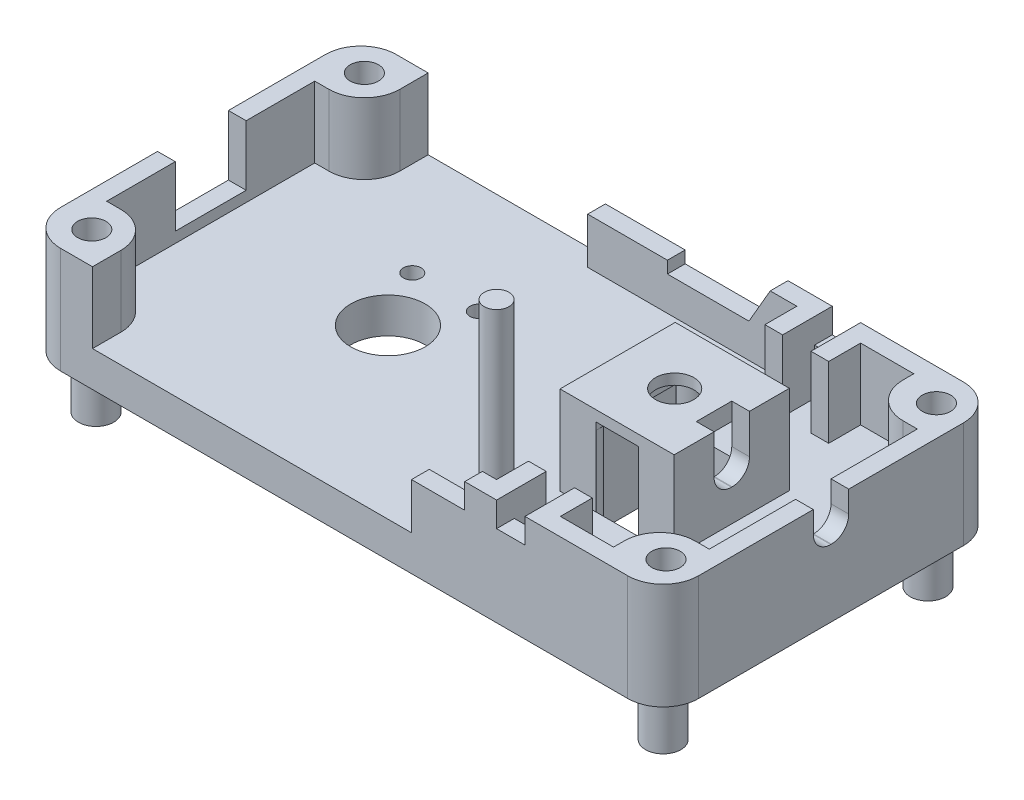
SolidWorks part; units mm, degrees
ref_plane "Front Plane" through (0, 0, 0) normal (0, 0, 1) x (1, 0, 0)
ref_plane "Top Plane" through (0, 0, 0) normal (0, 1, 0) x (1, 0, 0)
ref_plane "Right Plane" through (0, 0, 0) normal (1, 0, 0) x (0, 0, -1)
sketch "Sketch1" plane through (0, 0, 0) normal (0, 1, 0) x (1, 0, 0)
  line L1 (0, 0) -> (-45.72, 0)
  line L2 (0, 0) -> (0, 24.0538)
  line L3 (0, 24.0538) -> (-45.72, 24.0538)
  line L4 (-45.72, 0) -> (-45.72, 24.0538)
  dimension "D1" = 45.72
  dimension "D2" = 24.0538
extrude "Boss-Extrude1" add sketch "Sketch1" along normal blind 7.62
fillet "Fillet1" radius 2.54 4 edges at (0, 3.81, 0) (0, 3.81, -24.0538) (-45.72, 3.81, -24.0538) (-45.72, 3.81, 0)
sketch "Sketch2" plane through (0, 7.62, 0) normal (0, 1, 0) x (1, 0, 0)
  line L0 (-2.54, 24.0538) -> (-43.18, 24.0538) construction
  line L1 (-1.27, 4.572) -> (-44.45, 4.572)
  line L2 (-1.27, 4.572) -> (-1.27, 19.4818)
  line L3 (-1.27, 19.4818) -> (-44.45, 19.4818)
  line L4 (-44.45, 4.572) -> (-44.45, 19.4818)
  line L5 (-1.27, 4.572) -> (-44.45, 19.4818) construction
  line L6 (-1.27, 19.4818) -> (-44.45, 4.572) construction
  line L7 (-45.72, 21.5138) -> (-45.72, 2.54) construction
  line L8 (-43.18, 0) -> (-2.54, 0) construction
  line L9 (0, 2.54) -> (0, 21.5138) construction
  line L10 (0, 12.0269) -> (-45.72, 12.0269) construction
  line L12 (-7.112, 7.8994) -> (-15.2908, 7.8994)
  line L13 (-7.112, 7.8994) -> (-7.112, 16.1544)
  line L14 (-7.112, 16.1544) -> (-15.2908, 16.1544)
  line L15 (-15.2908, 7.8994) -> (-15.2908, 16.1544)
  line L16 (-7.112, 7.8994) -> (-15.2908, 16.1544) construction
  line L17 (-7.112, 16.1544) -> (-15.2908, 7.8994) construction
  point P0 (-22.86, 12.0269)
  point P15 (-11.2014, 12.0269)
  dimension "D1" = 4.572
  dimension "D2" = 1.27
  dimension "D3" = 4.572
  dimension "D4" = 1.27
  dimension "D5" = 7.112
  dimension "D6" = 8.1788
  dimension "D7" = 8.255
extrude "Cut-Extrude1" cut sketch "Sketch2" against normal blind 5.08
sketch "Sketch3" plane through (0, 7.62, 0) normal (0, 1, 0) x (1, 0, 0)
  line L0 (-44.45, 4.572) -> (-1.27, 4.572) construction
  line L1 (-18.034, 4.572) -> (-40.894, 4.572)
  line L2 (-18.034, 4.572) -> (-18.034, 0)
  line L3 (-18.034, 0) -> (-40.894, 0)
  line L4 (-40.894, 4.572) -> (-40.894, 0)
  line L5 (-43.18, 0) -> (-2.54, 0) construction
  dimension "D1" = 22.86
  dimension "D2" = 2.286
extrude "Cut-Extrude2" cut sketch "Sketch3" against normal blind 5.08
sketch "Sketch4" plane through (0, 7.62, 0) normal (0, 1, 0) x (1, 0, 0)
  line L6 (-1.27, 19.4818) -> (-44.45, 19.4818) construction
  line L7 (-40.894, 19.4818) -> (-28.194, 19.4818)
  line L8 (-40.894, 19.4818) -> (-40.894, 24.0538)
  line L9 (-40.894, 24.0538) -> (-28.194, 24.0538)
  line L10 (-28.194, 19.4818) -> (-28.194, 24.0538)
  line L11 (-2.54, 24.0538) -> (-43.18, 24.0538) construction
  dimension "D1" = 12.7
  dimension "D2" = 2.286
extrude "Cut-Extrude3" cut sketch "Sketch4" against normal blind 5.08
sketch "Sketch5" plane through (0, 0, 0) normal (0, -1, 0) x (1, 0, 0)
  line L0 (0, -2.54) -> (0, -21.5138) construction
  line L1 (-13.97, -7.8994) -> (-8.382, -7.8994)
  line L2 (-13.97, -7.8994) -> (-13.97, -16.1544)
  line L3 (-13.97, -16.1544) -> (-8.382, -16.1544)
  line L4 (-8.382, -7.8994) -> (-8.382, -16.1544)
  line L5 (-2.54, -24.0538) -> (-43.18, -24.0538) construction
  line L7 (-45.72, -12.0269) -> (0, -12.0269) construction
  line L8 (-45.72, -21.5138) -> (-45.72, -2.54) construction
  line L9 (-31.75, -12.0269) -> (-34.133, -16.1544) construction
  line L10 (-34.133, -16.1544) -> (-29.367, -16.1544) construction
  line L11 (-29.367, -16.1544) -> (-31.75, -12.0269) construction
  line L12 (-13.97, -16.1544) -> (-38.5605, -16.1544) construction
  line L13 (-19.1709, -19.9898) -> (-17.8269, -18.4658) construction
  line L14 (-19.7424, -19.4858) -> (-18.3984, -17.9618)
  line L15 (-18.5994, -20.4938) -> (-17.2554, -18.9698)
  circle A0 centre (-31.75, -12.0269) radius 2.667
  circle A1 centre (-34.133, -16.1544) radius 0.635
  circle A2 centre (-29.367, -16.1544) radius 0.635
  arc A3 (-19.7424, -19.4858) -> (-18.5994, -20.4938) centre (-19.1709, -19.9898) ccw
  arc A4 (-17.2554, -18.9698) -> (-18.3984, -17.9618) centre (-17.8269, -18.4658) ccw
  point P21 (-18.4989, -19.2278)
  dimension "D4" = 13.97
  dimension "D6" = 5.334
  dimension "D10" = 1.27
  dimension "D11" = 1.27
  dimension "D13" = 4.826
  dimension "D15" = 15.0812
  dimension "D16" = 0.762
  dimension "D1" = 8.382
  dimension "D2" = 5.588
  dimension "D3" = 8.255
  dimension "D5" = 4.1275
  dimension "D7" = 60
  dimension "D8" = 60
  dimension "D9" = 0
  dimension "D12" = 2.032
  dimension "D14" = 4.064
extrude "Cut-Extrude4" cut sketch "Sketch5" against normal blind 5.08
fillet "Fillet3" radius 2.54 1 edges at (-40.894, 5.08, -19.4818)
fillet "Fillet4" radius 2.54 1 edges at (-40.894, 5.08, -4.572)
sketch "Sketch6" plane through (0, 7.62, 0) normal (0, 1, 0) x (1, 0, 0)
  line L8 (-1.27, 19.4818) -> (-28.194, 19.4818) construction
  circle A1 centre (-43.18, 21.7678) radius 1.016
  circle A2 centre (-43.2308, 2.286) radius 1.016
  circle A4 centre (-2.1844, 21.7678) radius 1.016
  circle A5 centre (-2.1844, 2.3876) radius 1.016
  dimension "D1" = 2.032
  dimension "D2" = 2.032
  dimension "D5" = 2.286
  dimension "D6" = 2.032
  dimension "D8" = 2.032
  dimension "D3" = 2.286
  dimension "D4" = 2.4892
  dimension "D7" = 2.1844
  dimension "D9" = 2.54
  dimension "D10" = 2.286
  dimension "D11" = 2.3876
  dimension "D12" = 2.1844
extrude "Cut-Extrude5" cut sketch "Sketch6" against normal blind 6.604
sketch "Sketch7" plane through (0, 7.62, 0) normal (0, 1, 0) x (1, 0, 0)
  line L14 (-2.54, 24.0538) -> (-28.194, 24.0538) construction
  line L15 (-9.906, 24.0538) -> (-11.938, 24.0538)
  line L16 (-9.906, 24.0538) -> (-9.906, 0)
  line L17 (-9.906, 0) -> (-11.938, 0)
  line L18 (-11.938, 24.0538) -> (-11.938, 0)
  line L19 (-18.034, 0) -> (-2.54, 0) construction
  line L20 (-18.034, 0) -> (-18.034, 4.572) construction
  dimension "D1" = 6.096
  dimension "D2" = 2.032
extrude "Cut-Extrude6" cut sketch "Sketch7" against normal blind 1.778
sketch "Sketch10" plane through (0, 7.62, 0) normal (0, 1, 0) x (1, 0, 0)
  line L4 (-11.938, 24.0538) -> (-28.194, 24.0538) construction
  line L5 (-28.194, 19.4818) -> (-4.826, 19.4818)
  line L6 (-28.194, 19.4818) -> (-28.194, 22.7838)
  line L7 (-28.194, 22.7838) -> (-4.826, 22.7838)
  line L8 (-4.826, 19.4818) -> (-4.826, 22.7838)
  line L9 (0, 2.54) -> (0, 21.5138) construction
  line L10 (-9.906, 0) -> (-2.54, 0) construction
  line L11 (-18.034, 4.572) -> (-4.826, 4.572)
  line L12 (-18.034, 4.572) -> (-18.034, 1.27)
  line L13 (-18.034, 1.27) -> (-4.826, 1.27)
  line L14 (-4.826, 4.572) -> (-4.826, 1.27)
  dimension "D1" = 1.27
  dimension "D2" = 4.826
  dimension "D3" = 1.27
  dimension "D4" = 4.826
  dimension "D5" = 13.208
  dimension "D6" = 23.368
extrude "Cut-Extrude7" cut sketch "Sketch10" against normal blind 5.08
fillet "Fillet5" radius 2.54 1 edges at (-4.826, 5.08, -19.4818)
fillet "Fillet6" radius 2.54 1 edges at (-4.826, 5.08, -4.572)
sketch "Sketch14" plane through (0, 0, -24.0538) normal (0, 0, -1) x (-1, 0, 0)
  line L0 (15.113, 7.62) -> (16.637, 4.9804)
  line L1 (11.938, 7.62) -> (28.194, 7.62) construction
  line L2 (16.637, 4.9804) -> (22.479, 4.9804)
  line L3 (22.479, 4.9804) -> (22.479, 5.842)
  line L4 (22.479, 5.842) -> (28.194, 5.842)
  line L5 (28.194, 2.54) -> (28.194, 7.62) construction
  line L6 (11.938, 5.842) -> (11.938, 7.62) construction
  dimension "D1" = 3.175
  dimension "D2" = 1.524
  dimension "D3" = 5.842
  dimension "D4" = 60
  dimension "D5" = 1.778
extrude "Cut-Extrude8" cut sketch "Sketch14" against normal blind 7.62 and the other way through all
sketch "Sketch15" plane through (0, 0, 0) normal (0, 0, 1) x (1, 0, 0)
  line L0 (-11.938, 5.842) -> (-11.938, 7.62) construction
  line L1 (-18.034, 7.62) -> (-14.224, 7.62)
  line L2 (-18.034, 7.62) -> (-18.034, 5.842)
  line L3 (-18.034, 5.842) -> (-14.224, 5.842)
  line L4 (-14.224, 7.62) -> (-14.224, 5.842)
  dimension "D1" = 1.778
  dimension "D2" = 2.286
extrude "Cut-Extrude9" cut sketch "Sketch15" against normal blind 7.62
sketch "Sketch26" plane through (0, 0, -7.8994) normal (0, 0, 1) x (1, 0, 0)
  line L0 (-9.906, 7.62) -> (-7.112, 7.62) construction
  line L1 (-13.97, 5.08) -> (-8.382, 5.08)
  line L2 (-13.97, 5.08) -> (-13.97, 7.62)
  line L3 (-13.97, 7.62) -> (-8.382, 7.62)
  line L4 (-8.382, 5.08) -> (-8.382, 7.62)
  line L5 (-8.382, 5.08) -> (-8.382, 2.54) construction
  line L6 (-8.382, 5.08) -> (-13.97, 5.08) construction
extrude "Cut-Extrude15" cut sketch "Sketch26" against normal blind 9.652
sketch "Sketch27" plane through (0, 7.62, 0) normal (0, 1, 0) x (1, 0, 0)
  line L0 (-11.2014, 16.1544) -> (-11.2014, 7.8994) construction
  line L1 (-15.2908, 16.1544) -> (-7.112, 16.1544)
  line L2 (-15.2908, 16.1544) -> (-15.2908, 7.8994)
  line L3 (-15.2908, 7.8994) -> (-7.112, 7.8994)
  line L4 (-7.112, 16.1544) -> (-7.112, 7.8994)
  circle A0 centre (-11.2014, 12.0269) radius 1.3716
  dimension "D1" = 2.7432
extrude "Boss-Extrude16" add sketch "Sketch27" along normal blind 1.27
sketch "Sketch28" plane through (0, 0, 0) normal (0, -1, 0) x (1, 0, 0)
  line L1 (-13.97, -16.1544) -> (-12.7, -16.1544)
  line L2 (-13.97, -16.1544) -> (-13.97, -14.8844)
  line L3 (-13.97, -14.8844) -> (-13.9446, -14.8844)
  line L4 (-12.7, -16.1544) -> (-12.7, -16.129)
  line L5 (-8.382, -16.1544) -> (-9.652, -16.1544)
  line L6 (-8.382, -16.1544) -> (-8.382, -14.8844)
  line L7 (-8.382, -14.8844) -> (-8.4074, -14.8844)
  line L8 (-9.652, -16.1544) -> (-9.652, -16.129)
  line L9 (-8.382, -7.8994) -> (-9.652, -7.8994)
  line L10 (-8.382, -7.8994) -> (-8.382, -9.1694)
  line L11 (-8.382, -9.1694) -> (-8.4074, -9.1694)
  line L12 (-9.652, -7.8994) -> (-9.652, -7.9248)
  line L13 (-13.97, -7.8994) -> (-12.7, -7.8994)
  line L14 (-13.97, -7.8994) -> (-13.97, -9.1694)
  line L15 (-13.97, -9.1694) -> (-13.9446, -9.1694)
  line L16 (-12.7, -7.8994) -> (-12.7, -7.9248)
  arc A0 (-13.9446, -9.1694) -> (-12.7, -7.9248) centre (-13.9446, -7.9248) ccw
  arc A1 (-8.4074, -9.1694) -> (-9.652, -7.9248) centre (-8.4074, -7.9248) cw
  arc A2 (-9.652, -16.129) -> (-8.4074, -14.8844) centre (-8.4074, -16.129) cw
  arc A3 (-12.7, -16.129) -> (-13.9446, -14.8844) centre (-13.9446, -16.129) ccw
  point P22 (-12.7, -9.1694)
  point P25 (-9.652, -9.1694)
  point P28 (-9.652, -14.8844)
  point P31 (-12.7, -14.8844)
  dimension "D9" = 1.2446
  dimension "D1" = 1.27
  dimension "D2" = 1.27
  dimension "D3" = 1.27
  dimension "D4" = 1.27
  dimension "D5" = 1.27
  dimension "D6" = 1.27
  dimension "D7" = 1.27
  dimension "D8" = 1.27
extrude "Boss-Extrude17" add sketch "Sketch28" against normal blind 7.62
sketch "Sketch29" plane through (0, 8.89, 0) normal (0, 1, 0) x (1, 0, 0)
  line L0 (-15.2908, 12.0269) -> (-7.112, 12.0269) construction
  line L1 (-15.2908, 16.1544) -> (-15.2908, 7.8994) construction
  line L2 (-7.112, 7.8994) -> (-7.112, 16.1544) construction
  line L4 (-8.382, 10.7569) -> (-7.112, 10.7569)
  line L5 (-8.382, 10.7569) -> (-8.382, 13.2969)
  line L6 (-8.382, 13.2969) -> (-7.112, 13.2969)
  line L7 (-7.112, 10.7569) -> (-7.112, 13.2969)
  line L8 (-8.382, 10.7569) -> (-7.112, 13.2969) construction
  line L9 (-8.382, 13.2969) -> (-7.112, 10.7569) construction
  point P6 (-7.747, 12.0269)
  dimension "D1" = 1.27
  dimension "D2" = 2.54
extrude "Cut-Extrude16" cut sketch "Sketch29" against normal blind 1.778
sketch "Sketch30" plane through (0, 0, 0) normal (1, 0, 0) x (0, 0, -1)
  line L0 (12.0269, 7.62) -> (12.0269, 0) construction
  line L1 (13.2969, 7.62) -> (10.7569, 7.62) construction
  line L2 (2.54, 0) -> (21.5138, 0) construction
  line L3 (2.54, 7.62) -> (21.5138, 7.62) construction
  line L4 (12.0523, 4.826) -> (12.0015, 4.826)
  line L5 (13.2969, 6.0706) -> (13.2969, 7.62)
  line L6 (13.2969, 7.62) -> (10.7569, 7.62)
  line L7 (10.7569, 6.0706) -> (10.7569, 7.62)
  line L8 (13.2969, 4.826) -> (10.7569, 7.62) construction
  line L9 (13.2969, 7.62) -> (10.7569, 4.826) construction
  arc A0 (12.0523, 4.826) -> (13.2969, 6.0706) centre (12.0523, 6.0706) ccw
  arc A1 (10.7569, 6.0706) -> (12.0015, 4.826) centre (12.0015, 6.0706) ccw
  point P6 (12.0269, 6.223)
  dimension "D3" = 1.2446
  dimension "D1" = 2.794
  dimension "D2" = 2.54
extrude "Cut-Extrude17" cut sketch "Sketch30" against normal blind 8.89
sketch "Sketch32" plane through (0, 2.54, 0) normal (0, 1, 0) x (1, 0, 0)
  line L1 (-9.906, 1.27) -> (-8.636, 1.27)
  line L2 (-9.906, 1.27) -> (-9.906, 3.556)
  line L3 (-9.906, 3.556) -> (-8.636, 3.556)
  line L4 (-8.636, 1.27) -> (-8.636, 3.556)
  line L5 (-11.938, 1.27) -> (-13.208, 1.27)
  line L6 (-11.938, 1.27) -> (-11.938, 3.556)
  line L7 (-11.938, 3.556) -> (-13.208, 3.556)
  line L8 (-13.208, 1.27) -> (-13.208, 3.556)
  line L13 (-9.906, 22.7838) -> (-8.636, 22.7838)
  line L14 (-9.906, 22.7838) -> (-9.906, 20.4978)
  line L15 (-9.906, 20.4978) -> (-8.636, 20.4978)
  line L16 (-8.636, 22.7838) -> (-8.636, 20.4978)
  line L17 (-11.938, 22.7838) -> (-13.208, 22.7838)
  line L18 (-11.938, 22.7838) -> (-11.938, 20.4978)
  line L19 (-11.938, 20.4978) -> (-13.208, 20.4978)
  line L20 (-13.208, 22.7838) -> (-13.208, 20.4978)
  dimension "D1" = 1.27
  dimension "D2" = 1.27
  dimension "D3" = 1.27
  dimension "D4" = 1.27
  dimension "D5" = 2.286
  dimension "D6" = 2.286
  dimension "D7" = 2.286
  dimension "D8" = 2.286
extrude "Boss-Extrude18" add sketch "Sketch32" along normal blind 5.08
sketch "Sketch33" plane through (-45.72, 0, 0) normal (-1, 0, 0) x (0, 0, 1)
  line L0 (-12.0269, 7.62) -> (-12.0269, 0) construction
  line L1 (-21.5138, 7.62) -> (-2.54, 7.62) construction
  line L2 (-21.5138, 0) -> (-2.54, 0) construction
  line L4 (-9.4869, 3.302) -> (-14.5669, 3.302)
  line L5 (-9.4869, 3.302) -> (-9.4869, 7.62)
  line L6 (-9.4869, 7.62) -> (-14.5669, 7.62)
  line L7 (-14.5669, 3.302) -> (-14.5669, 7.62)
  line L8 (-9.4869, 3.302) -> (-14.5669, 7.62) construction
  line L9 (-9.4869, 7.62) -> (-14.5669, 3.302) construction
  point P6 (-12.0269, 5.461)
  dimension "D1" = 5.08
  dimension "D2" = 4.318
extrude "Cut-Extrude18" cut sketch "Sketch33" against normal blind 5.08
sketch "Sketch34" plane through (0, 0, -16.1544) normal (0, 0, -1) x (-1, 0, 0)
  line L6 (9.652, 7.62) -> (12.7, 7.62)
  line L7 (9.652, 7.62) -> (9.652, 8.128)
  line L8 (9.652, 8.128) -> (12.7, 8.128)
  line L9 (12.7, 7.62) -> (12.7, 8.128)
  dimension "D1" = 3.048
  dimension "D2" = 0.508
extrude "Cut-Extrude19" cut sketch "Sketch34" against normal blind 10.922
sketch "Sketch35" plane through (0, 2.54, 0) normal (0, 1, 0) x (1, 0, 0)
  line L0 (-40.894, 0) -> (-18.034, 0) construction
  line L1 (0, 2.54) -> (0, 10.7569) construction
  circle A0 centre (-16.764, 4.826) radius 0.889
  dimension "D1" = 1.778
  dimension "D2" = 4.826
  dimension "D3" = 16.764
extrude "Boss-Extrude19" add sketch "Sketch35" along normal blind 12.7
sketch "Sketch36" plane through (0, 0, 0) normal (0, -1, 0) x (1, 0, 0)
  line L0 (-43.18, 0) -> (-43.18, -24.0538) construction
  line L1 (-2.54, 0) -> (-2.54, -24.0538) construction
  line L2 (-45.72, -2.54) -> (0, -2.54) construction
  line L3 (-45.72, -21.5138) -> (0, -21.5138) construction
  line L4 (-45.72, -2.54) -> (-43.18, -2.54)
  line L5 (-45.72, -21.5138) -> (-43.18, -21.5138)
  line L6 (0, -2.54) -> (-2.54, -2.54)
  line L7 (0, -21.5138) -> (-2.54, -21.5138)
  arc A0 (-2.54, -24.0538) -> (0, -21.5138) centre (-2.54, -21.5138) ccw construction
  circle A1 centre (-43.18, -2.54) radius 1.27
  circle A2 centre (-43.18, -21.5138) radius 1.27
  circle A3 centre (-2.54, -2.54) radius 1.27
  circle A4 centre (-2.54, -21.5138) radius 1.27
  dimension "D1" = 2.54
  dimension "D2" = 2.54
  dimension "D3" = 2.54
  dimension "D4" = 2.54
extrude "Boss-Extrude20" add sketch "Sketch36" along normal blind 3.81
equation "\"0.25n\"=0.25"
